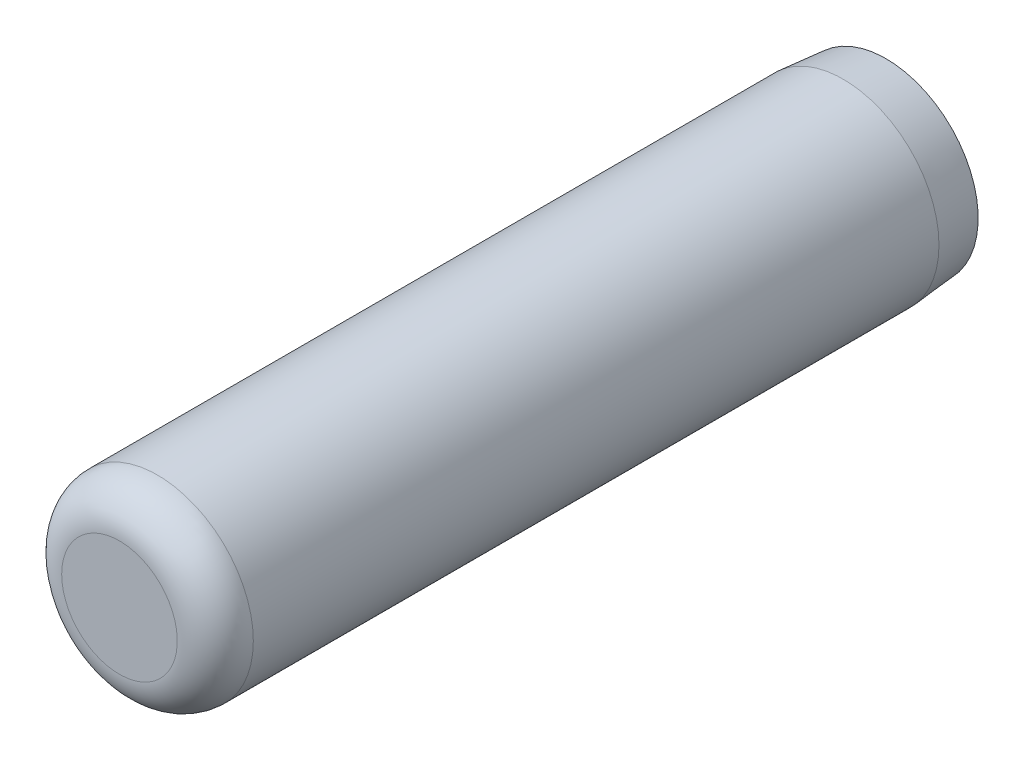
SolidWorks part; units mm, degrees
ref_plane "Front" through (0, 0, 0) normal (0, 0, 1) x (1, 0, 0)
ref_plane "Top" through (0, 0, 0) normal (0, 1, 0) x (1, 0, 0)
ref_plane "Right" through (0, 0, 0) normal (1, 0, 0) x (0, 0, -1)
sketch "Logo3_Revol_Axis" plane through (0, 0, 0) normal (0, 1, 0) x (1, 0, 0)
  line L0 (0, -30.1653) -> (0, 30.1653) construction
sketch "Logo3_bib1" plane through (0, 0, 0) normal (0, -1, 0) x (-1, 0, 0)
  line L0 (0, 15.875) -> (0, -15.875)
  line L1 (3.9688, 14.8116) -> (3.9688, -14.8116) construction
  line L2 (3.9688, -14.3002) -> (3.9688, 14.097)
  line L3 (0, 15.875) -> (3.8132, 15.875)
  line L4 (3.9688, 14.097) -> (3.8132, 15.875)
  line L5 (0, -15.875) -> (2.394, -15.875)
  line L10 (0, 47.5372) -> (0, -34.1764) construction
  arc A0 (3.9688, 14.8116) -> (0, 15.875) centre (0, 7.9375) ccw construction
  arc A1 (0, -15.875) -> (3.9688, -14.8116) centre (0, -7.9375) ccw construction
  arc A2 (2.394, -15.875) -> (3.9688, -14.3002) centre (2.394, -14.3002) ccw
revolve "Revolve1" add sketch "Logo3_bib1" angle 360 about L10
equation "\"ray2@Logo3_bib1\" = \"logo3_d1@Logo3_bib1\""
equation "\"Ray1@Logo3_bib1\" = \"logo3_d1@Logo3_bib1\""
equation "\"dia1@Logo3_bib1\" = \"logo3_d1@Logo3_bib1\"/2"
